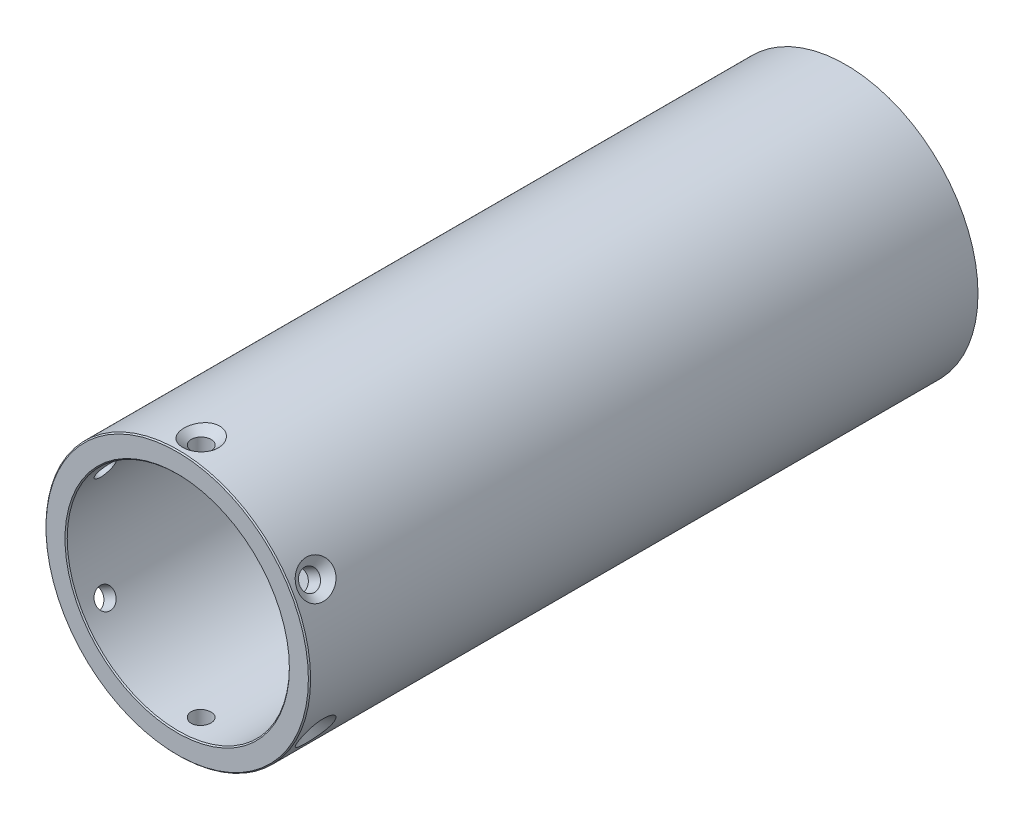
SolidWorks part; units mm, degrees
ref_plane "Front Plane" through (0, 0, 0) normal (0, 0, 1) x (1, 0, 0)
ref_plane "Top Plane" through (0, 0, 0) normal (0, 1, 0) x (1, 0, 0)
ref_plane "Right Plane" through (0, 0, 0) normal (1, 0, 0) x (0, 0, -1)
sketch "Sketch1" plane through (0, 0, 0) normal (0, 0, 1) x (1, 0, 0)
  line L0 (-30.1625, 0) -> (-24.2951, 0) construction
  line L1 (-24.2951, 0) -> (24.2951, 0) construction
  line L2 (24.2951, 0) -> (30.1625, 0) construction
  line L3 (0, 0) -> (-15.0813, -26.1215) construction
  circle A0 centre (0, 0) radius 30.1625
  circle A1 centre (0, 0) radius 24.2951
  point P8 (-15.0813, -26.1215)
sketch "Sketch2" plane through (0, 0, 0) normal (1, 0, 0) x (0, 0, -1)
  line L0 (-76.2, 0) -> (76.2, 0) construction
  point P2 (-0.7937, 0)
  point P3 (0.7937, 0)
sketch "Sketch3" plane through (0, 0, 0) normal (0, 0, 1) x (1, 0, 0)
  circle A0 centre (0, 0) radius 30.1625 construction
  circle A1 centre (0, 0) radius 24.2951 construction
  circle A2 centre (0, 0) radius 30.1625
  circle A3 centre (0, 0) radius 24.2951
extrude "Boss-Extrude1" add sketch "Sketch3" along normal up to vertex (76.2 mm away) and the other way up to vertex (76.2 mm away)
sketch "Sketch4" plane through (0, 0, 76.2) normal (0, 0, 1) x (1, 0, 0)
  circle A0 centre (0, 0) radius 25.3238
  dimension "D1" = 50.6476
extrude "Cut-Extrude1" cut sketch "Sketch4" against normal up to next
ref_plane "Plane1" through (0, 30.1625, 0) normal (0, 1, 0) x (1, 0, 0)
hole_wizard "CSK for #8 Flat Head Machine Screw (100)1" positions "Sketch6" profile "Sketch7" countersink size "#8" standard "ANSI Inch"
sketch "Sketch6" plane through (0, 30.1625, 0) normal (0, 1, 0) x (1, 0, 0)
  line L0 (0, 0) -> (0, -70.7302)
  line L2 (-30.1625, -76.2) -> (30.1625, -76.2) construction
  point P0 (0, -70.7302)
  dimension "D1" = 5.4698
sketch "Sketch7" plane through (0, 30.1625, 70.7302) normal (1, 0, 0) x (0, 0, 1)
  line L0 (0, 0) -> (0, 18.4449)
  line L1 (0, 18.4449) -> (2.2479, 17.0942)
  line L2 (2.2479, 17.0942) -> (2.2479, 1.6518)
  line L3 (2.2479, 1.6518) -> (4.2164, 0)
  line L5 (4.2164, 0) -> (0, 0)
  line L6 (-2.2479, 1.6518) -> (-4.2164, 0) construction
  line L10 (0, 18.4449) -> (-2.2479, 17.0942) construction
  line L11 (0, -6.35) -> (0, 107.95) construction
  dimension "Hole Dia." = 4.4958
  dimension "Hole Depth" = 17.0942
  dimension "Near C'Sink Dia." = 8.4328
  dimension "Near C'Sink Angle" = 100
  dimension "Drill Angle" = 118
pattern_circular "CirPattern1" count 6 over 360 about axis through (0, 0, 76.2) along (0, 0, -1) of "CSK for #8 Flat Head Machine Screw (100)1"
chamfer "Chamfer1" distance 0.254 angle 45 2 edges at (30.1625, 0, 76.2) (25.3238, 0, 76.2)
equation "\"D1@Sketch2\"=\"OD@Sketch1\"*1.25"
equation "\"D2@Sketch2\"=\"OD@Sketch1\"*1.25"
